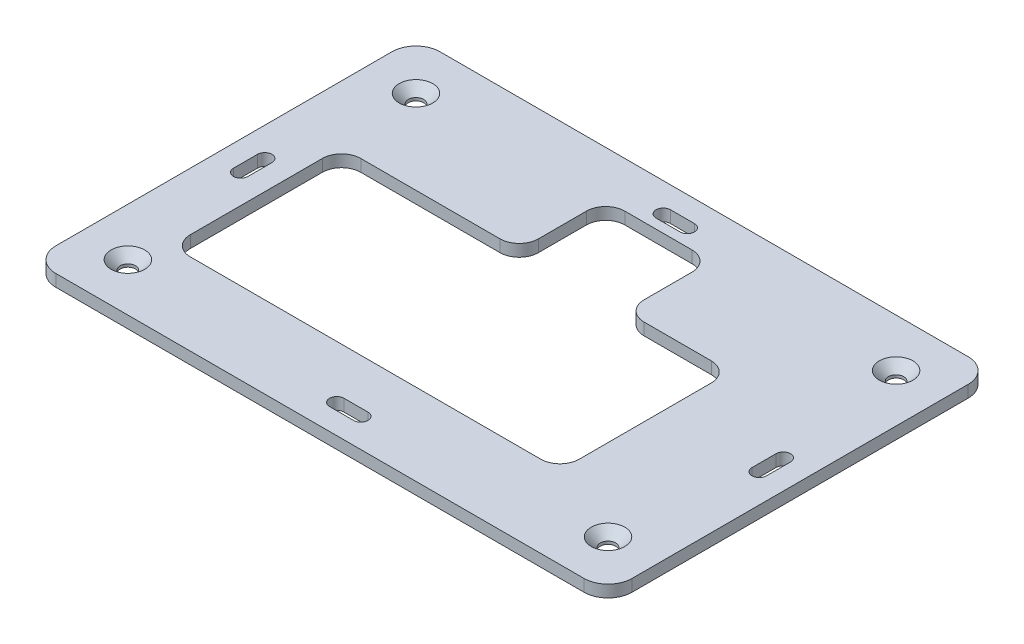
SolidWorks part; units mm, degrees
ref_plane "Alzado" through (0, 0, 0) normal (0, 0, 1) x (1, 0, 0)
ref_plane "Planta" through (0, 0, 0) normal (0, 1, 0) x (1, 0, 0)
ref_plane "Vista lateral" through (0, 0, 0) normal (1, 0, 0) x (0, 0, -1)
sketch "Croquis1" plane through (0, 0, 0) normal (0, 1, 0) x (1, 0, 0)
  line L1 (-60, -40) -> (60, -40)
  line L2 (-60, -40) -> (-60, 40)
  line L3 (-60, 40) -> (60, 40)
  line L4 (60, -40) -> (60, 40)
  line L5 (-60, -40) -> (60, 40) construction
  line L6 (-60, 40) -> (60, -40) construction
  point P0 (0, 0)
  dimension "D1" = 120
  dimension "D2" = 80
extrude "Saliente-Extruir1" add sketch "Croquis1" along normal blind 2.5
fillet "Redondeo1" radius 5 4 edges at (-60, 1.25, -40) (60, 1.25, -40) (-60, 1.25, 40) (60, 1.25, 40)
sketch "Croquis2" plane through (0, 2.5, 0) normal (0, 1, 0) x (1, 0, 0)
  line L1 (-48, -23) -> (33, -23)
  line L2 (-48, -23) -> (-48, 12.5)
  line L3 (-48, 12.5) -> (33, 12.5)
  line L4 (33, -23) -> (33, 12.5)
  point P0 (0, 0)
  dimension "D2" = 48
  dimension "D3" = 33
  dimension "D4" = 12.5
  dimension "D5" = 23
extrude "Cortar-Extruir1" cut sketch "Croquis2" against normal through all
sketch "Croquis3" plane through (0, 2.5, 0) normal (0, 1, 0) x (1, 0, 0)
  line L1 (-50, -30) -> (50, -30) construction
  line L2 (-50, -30) -> (-50, 30) construction
  line L3 (-50, 30) -> (50, 30) construction
  line L4 (50, -30) -> (50, 30) construction
  line L5 (-50, -30) -> (50, 30) construction
  line L6 (-50, 30) -> (50, -30) construction
  circle A0 centre (-50, 30) radius 1.6
  circle A1 centre (50, 30) radius 1.6
  circle A2 centre (50, -30) radius 1.6
  circle A3 centre (-50, -30) radius 1.6
  point P8 (0, 0)
  dimension "D3" = 3.2
  dimension "D1" = 60
  dimension "D2" = 100
extrude "Cortar-Extruir2" cut sketch "Croquis3" against normal through all
chamfer "Chaflán1" distance 1.9 angle 45 4 edges at (-50, 2.5, -28.4) (-50, 2.5, 31.6) (50, 2.5, 31.6) (50, 2.5, -28.4)
sketch "Croquis4" plane through (0, 0, 0) normal (0, -1, 0) x (1, 0, 0)
  line L0 (33, -12.5) -> (-48, -12.5) construction
  line L1 (-11, -30.5) -> (11, -30.5)
  line L2 (-11, -30.5) -> (-11, -2.9593)
  line L3 (-11, -2.9593) -> (11, -2.9593)
  line L4 (11, -30.5) -> (11, -2.9593)
  line L8 (-48, -12.5) -> (-48, 23) construction
  line L9 (33, 23) -> (33, -12.5) construction
  dimension "D1" = 18
  dimension "D2" = 37
  dimension "D3" = 22
extrude "Cortar-Extruir3" cut sketch "Croquis4" against normal through all
fillet "Redondeo4" radius 4 8 edges at (11, 1.25, -30.5) (-11, 1.25, -30.5) (11, 1.25, -12.5) (-11, 1.25, -12.5) (33, 1.25, -12.5) (33, 1.25, 23) (-48, 1.25, 23) (-48, 1.25, -12.5)
sketch "Croquis5" plane through (0, 0, 0) normal (0, -1, 0) x (1, 0, 0)
  line L0 (-55, 40) -> (55, 40) construction
  line L1 (-2.5, 35.5) -> (2.5, 35.5)
  line L2 (-2.5, 35.5) -> (-2.5, 32.5) construction
  line L3 (-2.5, 32.5) -> (2.5, 32.5)
  line L4 (2.5, 35.5) -> (2.5, 32.5) construction
  line L9 (-2.5, -32.5) -> (2.5, -32.5)
  line L10 (-2.5, -32.5) -> (-2.5, -35.5) construction
  line L11 (-2.5, -35.5) -> (2.5, -35.5)
  line L12 (2.5, -32.5) -> (2.5, -35.5) construction
  line L17 (52.5, 2.5) -> (55.5, 2.5) construction
  line L18 (52.5, 2.5) -> (52.5, -2.5)
  line L19 (52.5, -2.5) -> (55.5, -2.5) construction
  line L20 (55.5, 2.5) -> (55.5, -2.5)
  line L21 (-55.5, 2.5) -> (-52.5, 2.5) construction
  line L22 (-55.5, 2.5) -> (-55.5, -2.5)
  line L23 (-55.5, -2.5) -> (-52.5, -2.5) construction
  line L24 (-52.5, 2.5) -> (-52.5, -2.5)
  line L25 (-52.5, 32.5) -> (52.5, 32.5) construction
  line L26 (-52.5, 32.5) -> (-52.5, -32.5) construction
  line L27 (-52.5, -32.5) -> (52.5, -32.5) construction
  line L28 (52.5, 32.5) -> (52.5, -32.5) construction
  line L29 (-52.5, 32.5) -> (52.5, -32.5) construction
  line L30 (-52.5, -32.5) -> (52.5, 32.5) construction
  line L31 (-60, -35) -> (-60, 35) construction
  arc A0 (-2.5, 35.5) -> (-2.5, 32.5) centre (-2.5, 34) ccw
  arc A1 (2.5, 32.5) -> (2.5, 35.5) centre (2.5, 34) ccw
  arc A2 (-52.5, 2.5) -> (-55.5, 2.5) centre (-54, 2.5) ccw
  arc A3 (-55.5, -2.5) -> (-52.5, -2.5) centre (-54, -2.5) ccw
  arc A4 (55.5, 2.5) -> (52.5, 2.5) centre (54, 2.5) ccw
  arc A5 (52.5, -2.5) -> (55.5, -2.5) centre (54, -2.5) ccw
  arc A6 (2.5, -35.5) -> (2.5, -32.5) centre (2.5, -34) ccw
  arc A7 (-2.5, -32.5) -> (-2.5, -35.5) centre (-2.5, -34) ccw
  point P5 (0, -32.5)
  point P6 (0, 32.5)
  point P12 (-52.5, 0)
  point P28 (0, 0)
  point P34 (0, 40)
  point P37 (-60, 0)
  dimension "D1" = 3
  dimension "D2" = 3
  dimension "D3" = 65
  dimension "D4" = 105
  dimension "D5" = 5
  dimension "D6" = 5
extrude "Cortar-Extruir4" cut sketch "Croquis5" against normal blind 10
